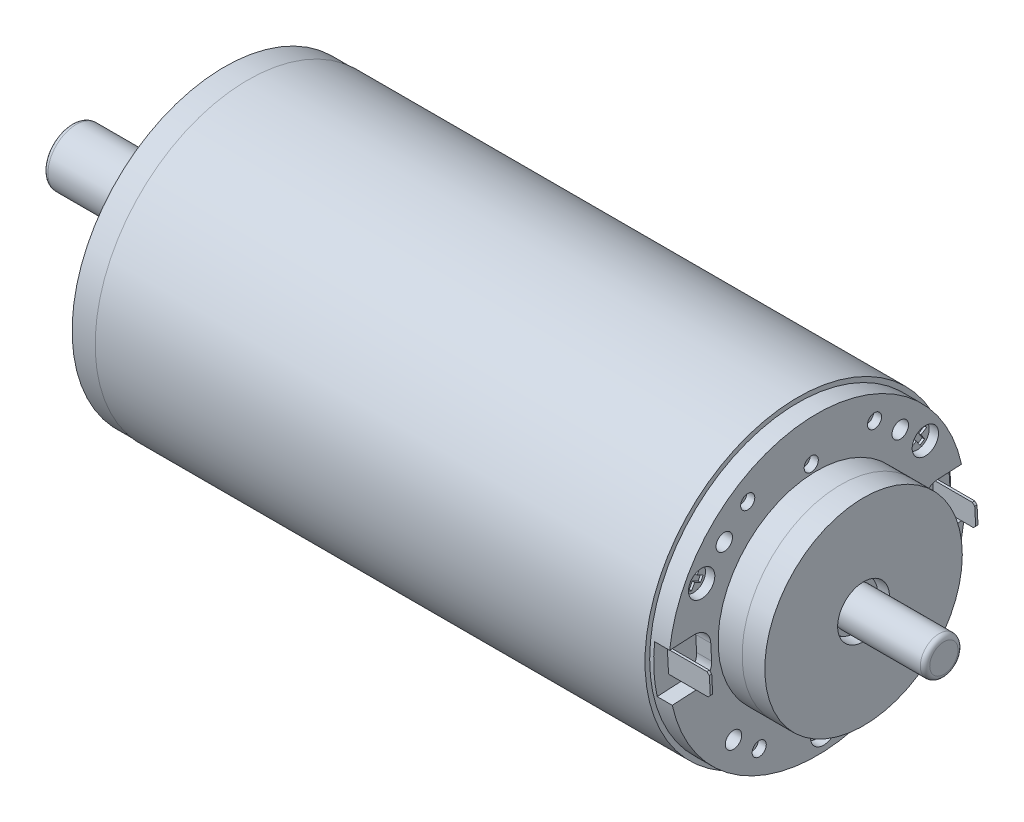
SolidWorks part; units mm, degrees
ref_plane "Front Plane" through (0, 0, 0) normal (0, 0, 1) x (1, 0, 0)
ref_plane "Top Plane" through (0, 0, 0) normal (0, 1, 0) x (1, 0, 0)
ref_plane "Right Plane" through (0, 0, 0) normal (1, 0, 0) x (0, 0, -1)
imported_body "Imported16"
imported_body "Imported17"
imported_body "Imported18"
imported_body "Imported19"
imported_body "Imported20"
imported_body "Surface-Imported51"
imported_body "Surface-Imported52"
imported_body "Surface-Imported53"
imported_body "Surface-Imported54"
imported_body "Surface-Imported55"
imported_body "Surface-Imported56"
imported_body "Surface-Imported57"
imported_body "Surface-Imported58"
sketch "Sketch1" plane through (126.3, 0, 0) normal (1, 0, 0) x (0, 0, -1)
  line L0 (-19.6933, 17.732) -> (17.732, 19.6933) construction
  line L1 (-0.9807, 18.7126) -> (-2.9593, 56.4661) construction
sketch "Sketch3" plane through (131.4, 0, 0) normal (1, 0, 0) x (0, 0, -1)
  circle A0 centre (0, 0) radius 5.5121
  circle A1 centre (0, 0) radius 21
  circle A2 centre (0, 0) radius 21 construction
extrude "Boss-Extrude1" add sketch "Sketch3" along normal blind 4.826 separate body
